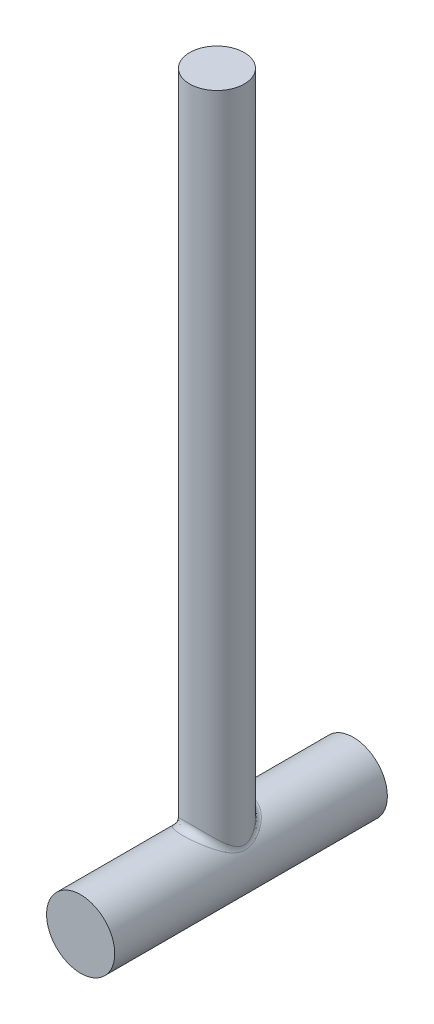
SolidWorks part; units mm, degrees
ref_plane "Front Plane" through (0, 0, 0) normal (0, 0, 1) x (1, 0, 0)
ref_plane "Top Plane" through (0, 0, 0) normal (0, 1, 0) x (1, 0, 0)
ref_plane "Right Plane" through (0, 0, 0) normal (1, 0, 0) x (0, 0, -1)
sketch "Sketch1" plane through (0, 0, 0) normal (0, 0, 1) x (1, 0, 0)
  circle A0 centre (0, 0) radius 5
  dimension "D1" = 10
extrude "Boss-Extrude1" add sketch "Sketch1" along normal mid plane 40
sketch "Sketch2" plane through (0, 0, 0) normal (0, 1, 0) x (1, 0, 0)
  circle A0 centre (0, 0) radius 4
  dimension "D1" = 8
extrude "Boss-Extrude2" add sketch "Sketch2" along normal blind 100
fillet "Fillet1" radius 1 1 edges at (0.4686, 4.978, 3.9725)
